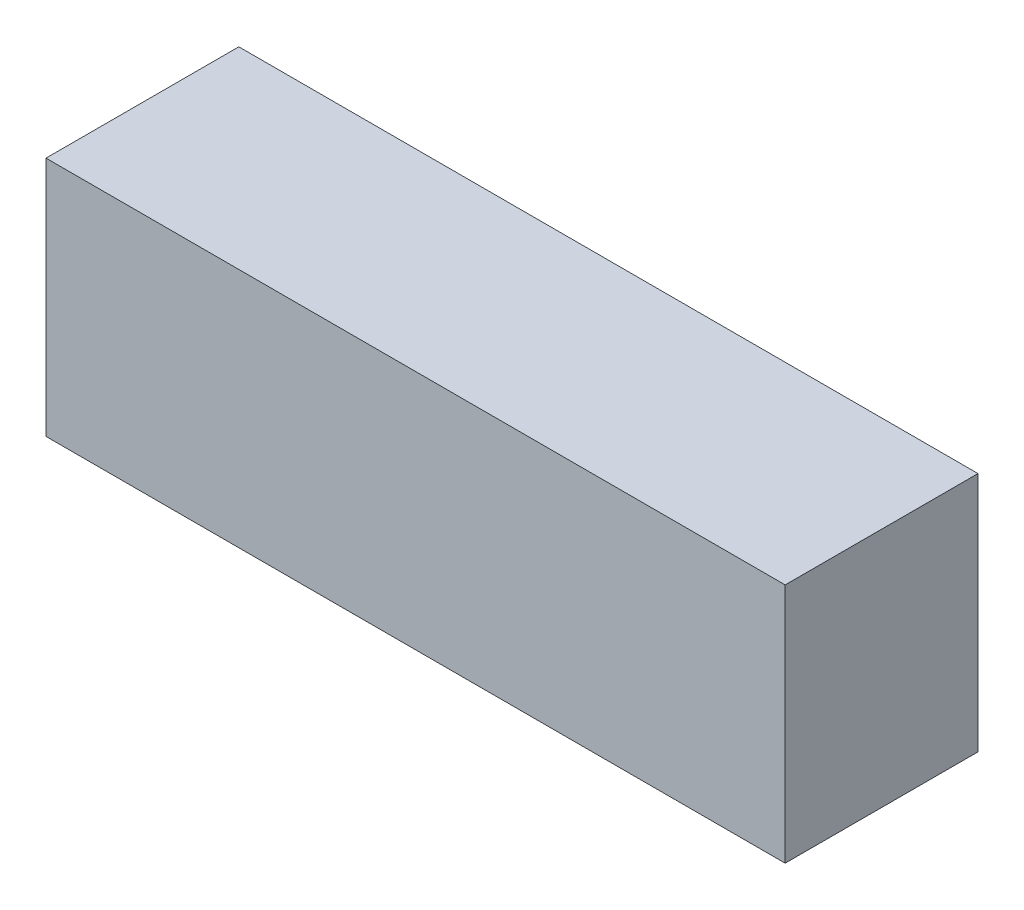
SolidWorks part; units mm, degrees
ref_plane "Front Plane" through (0, 0, 0) normal (0, 0, 1) x (1, 0, 0)
ref_plane "Top Plane" through (0, 0, 0) normal (0, 1, 0) x (1, 0, 0)
ref_plane "Right Plane" through (0, 0, 0) normal (1, 0, 0) x (0, 0, -1)
sketch "Sketch1" plane through (0, 0, 0) normal (0, 1, 0) x (1, 0, 0)
  line L1 (-115, 30) -> (115, 30)
  line L2 (-115, 30) -> (-115, -30)
  line L3 (-115, -30) -> (115, -30)
  line L4 (115, 30) -> (115, -30)
  line L5 (-115, 30) -> (115, -30) construction
  line L6 (-115, -30) -> (115, 30) construction
  point P0 (0, 0)
  dimension "D1" = 230
  dimension "D2" = 60
extrude "Boss-Extrude1" add sketch "Sketch1" along normal mid plane 75
